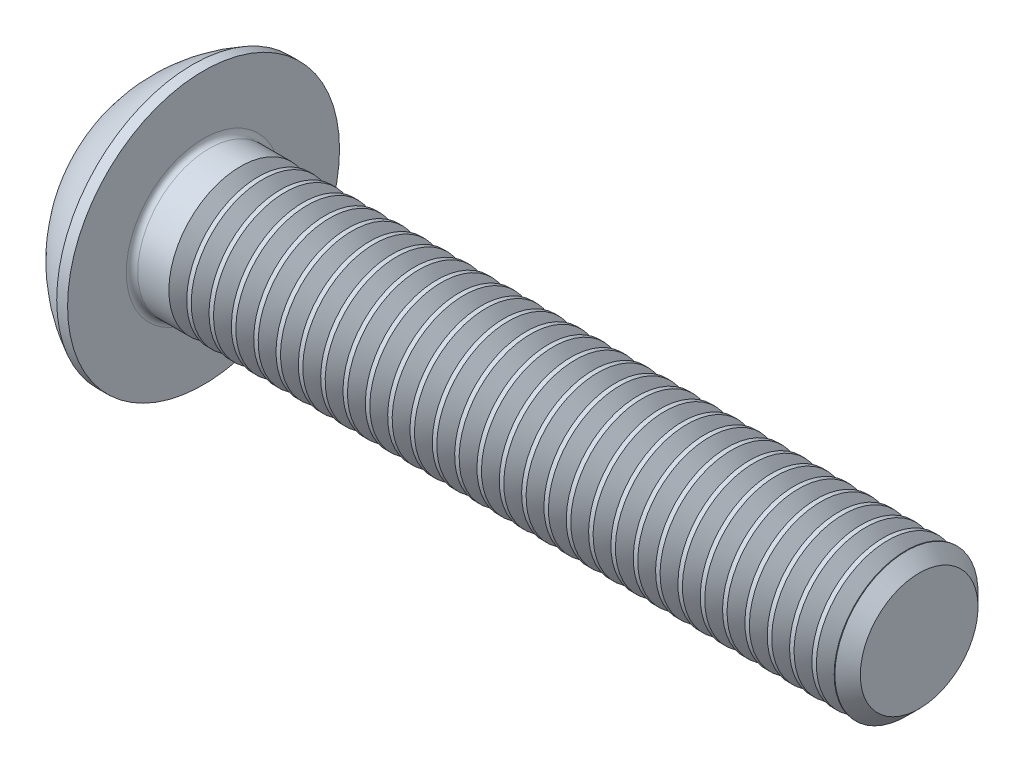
SolidWorks part; units mm, degrees
ref_plane "Plane1" through (0, 0, 0) normal (0, 0, 1) x (1, 0, 0)
ref_plane "Plane2" through (0, 0, 0) normal (0, 1, 0) x (1, 0, 0)
ref_plane "Plane3" through (0, 0, 0) normal (1, 0, 0) x (0, 0, -1)
sketch "BodySke" plane through (0, 0, 0) normal (0, 0, 1) x (1, 0, 0)
  line L0 (27.75, 0) -> (27.75, 2.055)
  line L1 (27.305, 2.5) -> (2.75, 2.5)
  line L2 (2.75, 2.5) -> (2.75, 4.75)
  line L3 (2.75, 4.75) -> (2.37, 4.75)
  line L4 (0, 0) -> (101.6, 0) construction
  line L5 (2.75, -4.75) -> (2.37, -4.75) construction
  line L6 (55.6768, -2.5) -> (2.75, -2.5) construction
  line L7 (27.75, 0) -> (0, 0)
  line L8 (0, 2.375) -> (0, -2.375) construction
  line L9 (0, 0) -> (0, 2.375)
  line L10 (27.75, 2.055) -> (27.305, 2.5)
  line L11 (27.75, -2.055) -> (27.305, -2.5) construction
  line L12 (3.55, 9.525) -> (3.55, -2.5) construction
  line L13 (2.75, 9.525) -> (2.75, -2.5) construction
  arc A1 (0, 2.375) -> (2.37, 4.75) centre (4.755, 0) cw
  dimension "D1" = 4.75
  dimension "Diameter" = 5
  dimension "Length" = 25
  dimension "Head_dia" = 9.5
  dimension "Head_ht" = 2.75
  dimension "Head_side_ht" = 0.38
  dimension "Minor_dia" = 4.11
  dimension "Body_ch_ang" = 45
  dimension "Advance" = 0.8
  dimension "Thread_nom" = 25
revolve "BaseBody" add sketch "BodySke" angle 360 about L4
fillet "Fillet1" radius 0.2 1 edges at (2.75, 0, 2.5)
sketch "Sketch2" plane through (0, 0, 0) normal (0, 0, 1) x (1, 0, 0)
  line L0 (0, 1.5) -> (1.56, 1.5)
  line L1 (1.56, 1.5) -> (2.426, 0)
  line L3 (2.426, 0) -> (0, 0)
  line L4 (0, 0) -> (0, 1.5)
  line L5 (0, -1.5) -> (1.56, -1.5) construction
  line L6 (0, 0) -> (47.625, 0) construction
  dimension "D2" = 60
  dimension "PreBroach_depth" = 1.56
  dimension "PreBroach_dia" = 3
revolve "PreBroach" cut sketch "Sketch2" angle 360 about L6
sketch "Sketch3" plane through (0, 0, 0) normal (1, 0, 0) x (0, 0, -1)
  line L0 (-1.5, -0.866) -> (-1.5, 0.866)
  line L1 (-1.5, 0.866) -> (0, 1.7321)
  line L2 (0, 1.7321) -> (1.5, 0.866)
  line L3 (1.5, 0.866) -> (1.5, -0.866)
  line L4 (1.5, -0.866) -> (0, -1.7321)
  line L5 (0, -1.7321) -> (-1.5, -0.866)
  dimension "D1" = 1.5
  dimension "D2" = 1.5
  dimension "D3" = 3
  dimension "Hex_size" = 3
extrude "Hex" cut sketch "Sketch3" along normal blind 1.56
sketch "ThdSchSke" plane through (0, 0, 0) normal (0, 0, 1) x (1, 0, 0)
  line L0 (4.35, -2.055) -> (4.0384, -2.5)
  line L1 (4.35, -2.055) -> (4.6616, -2.5)
  line L2 (4.6616, -2.5) -> (4.6616, -3.125)
  line L3 (-3.175, 0) -> (5.1513, 0) construction
  line L5 (4.6616, -3.125) -> (4.0384, -3.125)
  line L6 (4.0384, -3.125) -> (4.0384, -2.5)
  dimension "Thread_minor" = 4.11
  dimension "Diameter" = 5
  dimension "Start" = 4.35
  dimension "SideAngle" = 55
  dimension "VeeAngle" = 70
  dimension "Overcut" = 6.25
revolve "ThreadSchematic" cut sketch "ThdSchSke" angle 360 about L3
pattern_linear "ThdSchPat" count 30 spacing 0.78 along (1, 0, 0) of "ThreadSchematic"
equation "\"D1@BodySke\" = \"Head_dia@BodySke\" * .5"
equation "\"Thread_minor@ThreadCosmetic\" = \"Minor_dia@BodySke\""
equation "\"D1@Sketch3\" = \"Hex_size@Sketch3\" / 2"
equation "\"D2@Sketch3\" = \"D1@Sketch3\""
equation "\"D3@Sketch3\" = \"Hex_size@Sketch3\""
equation "\"Thread_length@ThreadCosmetic\" = ((sgn( (\"Length@BodySke\" - \"Advance@BodySke\" * 2.0) - \"Thread_nom@BodySke\" )-1)*( (\"Length@BodySke\" - \"Advance@BodySke\" * 2.0) - \"Thread_nom@BodySke\" ))/-2+ \"Thread_no"
equation "\"Thread_minor@ThdSchSke\" = \"Minor_dia@BodySke\""
equation "\"Diameter@ThdSchSke\" = \"Diameter@BodySke\""
equation "\"Overcut@ThdSchSke\" = \"Diameter@BodySke\" * 1.25"
equation "\"Start@ThdSchSke\" = \"Head_ht@BodySke\" + \"Length@BodySke\" - \"Thread_length@ThreadCosmetic\"  '---Non-countersunk---"
equation "\"Num_threads@ThdSchPat\" = int( \"Thread_length@ThreadCosmetic\" / \"Advance@BodySke\" + 0.999 )  + 1"
equation "\"Advance@ThdSchPat\" = \"Thread_length@ThreadCosmetic\" /  (\"Num_threads@ThdSchPat\" - 1) 'relax it"
equation "\"Num_threads@ThdSchPat\" = \"Num_threads@ThdSchPat\" - sgn( \"Num_threads@ThdSchPat\" - 1) '---chamfered tips only---"
